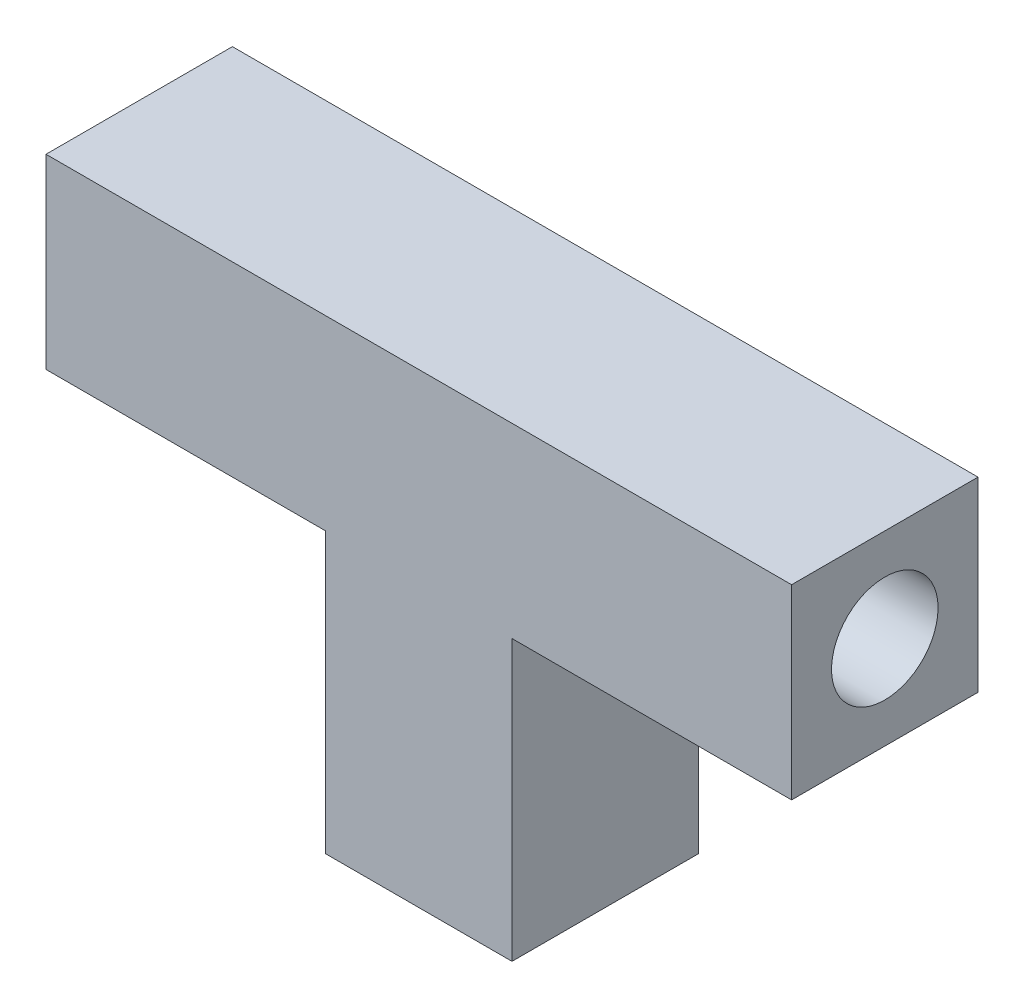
SolidWorks part; units mm, degrees
ref_plane "Front Plane" through (0, 0, 0) normal (0, 0, 1) x (1, 0, 0)
ref_plane "Top Plane" through (0, 0, 0) normal (0, 1, 0) x (1, 0, 0)
ref_plane "Right Plane" through (0, 0, 0) normal (1, 0, 0) x (0, 0, -1)
sketch "Sketch1" plane through (0, 0, 0) normal (0, 0, 1) x (1, 0, 0)
  line L0 (-7, 1.75) -> (7, 1.75)
  line L1 (7, 1.75) -> (7, -1.75)
  line L2 (7, -1.75) -> (1.75, -1.75)
  line L3 (1.75, -1.75) -> (1.75, -7)
  line L4 (1.75, -7) -> (-1.75, -7)
  line L5 (-1.75, -7) -> (-1.75, -1.75)
  line L6 (-1.75, -1.75) -> (-7, -1.75)
  line L7 (-7, -1.75) -> (-7, 1.75)
  point P3 (0, -7)
  point P9 (-7, 0)
  dimension "D1" = 14
  dimension "D2" = 3.5
extrude "Boss-Extrude1" add sketch "Sketch1" along normal mid plane 3.5
sketch "Sketch2" plane through (0, 0, 0) normal (1, 0, 0) x (0, 0, -1)
  circle A0 centre (0, 0) radius 1
  dimension "D1" = 2
extrude "Cut-Extrude1" cut sketch "Sketch2" against normal through all both and the other way through all
sketch "Sketch3" plane through (0, 0, 0) normal (0, 1, 0) x (1, 0, 0)
  circle A0 centre (0, 0) radius 1
  dimension "D1" = 2
extrude "Cut-Extrude2" cut sketch "Sketch3" against normal up to surface (7 mm away)
sketch "Sketch4" plane through (0, 0, 0) normal (1, 0, 0) x (0, 0, -1)
  line L0 (0, 1.75) -> (0, -7)
  line L1 (-1.75, 1.75) -> (1.75, 1.75) construction
  line L2 (-1.75, -7) -> (1.75, -7) construction
  line L3 (0, -7) -> (-1.75, -7)
  line L4 (-1.75, -7) -> (-1.75, 1.75)
  line L5 (-1.75, 1.75) -> (0, 1.75)
extrude "Cut-Extrude3" [suppressed] cut sketch "Sketch4" against normal through all both and the other way through all
